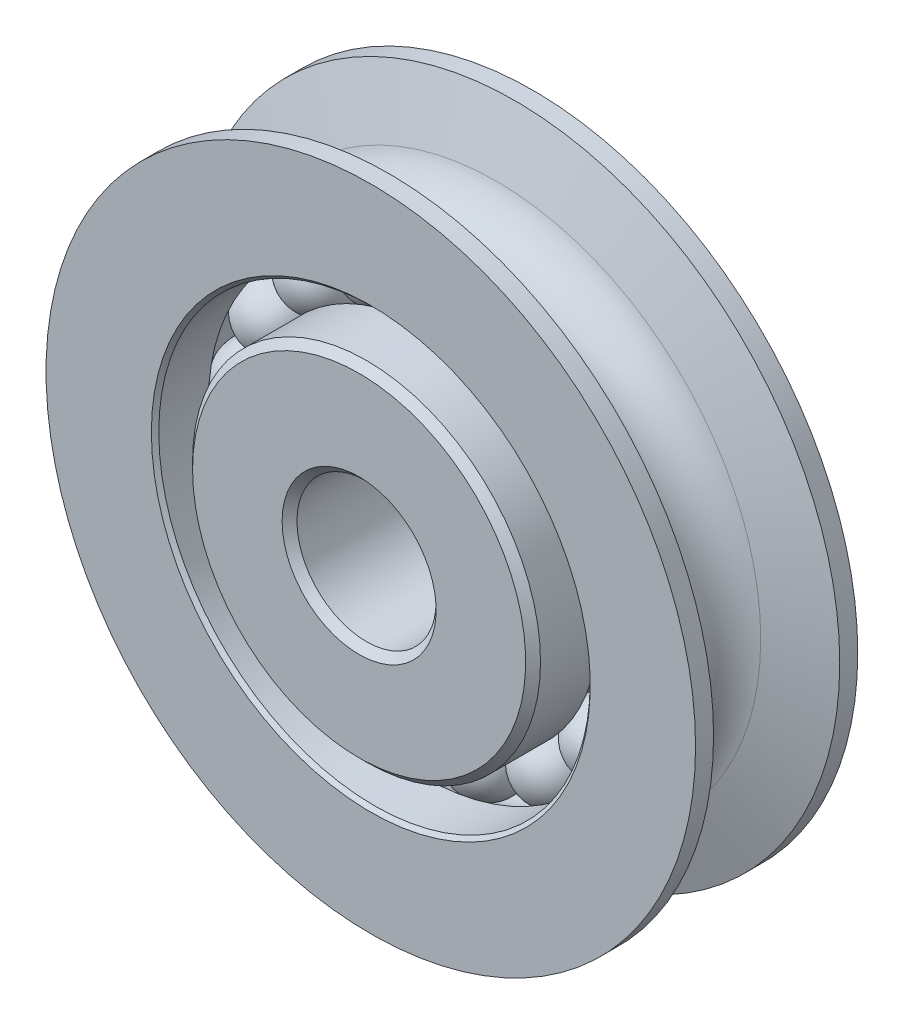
SolidWorks part; units mm, degrees
ref_plane "Front" through (0, 0, 0) normal (0, 0, 1) x (1, 0, 0)
ref_plane "Top" through (0, 0, 0) normal (0, 1, 0) x (1, 0, 0)
ref_plane "Right" through (0, 0, 0) normal (1, 0, 0) x (0, 0, -1)
sketch "Sketch1" plane through (0, 0, 0) normal (1, 0, 0) x (0, 0, -1)
  line L0 (4.318, 22.225) -> (5.5499, 22.225)
  line L1 (-4.318, 22.225) -> (-5.5499, 22.225)
  line L2 (-4.318, 22.225) -> (-3.0306, 18.1034)
  line L3 (1.905, 14.7638) -> (5.5499, 14.7638)
  line L4 (6.35, 4.7625) -> (-6.35, 4.7625)
  line L5 (-1.905, 11.9063) -> (-6.35, 11.9063)
  line L6 (4.318, 22.225) -> (3.0306, 18.1034)
  line L8 (-6.35, 0) -> (6.35, 0) construction
  line L10 (5.5499, 22.225) -> (5.5499, 14.7638)
  line L13 (-6.35, 11.9063) -> (-6.35, 4.7625)
  line L14 (0, 15.875) -> (0, -15.875) construction
  line L16 (6.35, 11.9063) -> (6.35, 4.7625)
  line L17 (-5.5499, 22.225) -> (-5.5499, -22.225) construction
  line L18 (-5.5499, 14.7638) -> (-1.905, 14.7638)
  line L20 (6.35, 11.9063) -> (1.905, 11.9063)
  line L21 (-5.5499, 14.7638) -> (-5.5499, 22.225)
  arc A0 (-3.0306, 18.1034) -> (3.0306, 18.1034) centre (0, 19.05) ccw
  circle A1 centre (0, 19.05) radius 3.175 construction
  circle A2 centre (0, 0) radius 4.7625 construction
  circle A3 centre (0, 0) radius 11.9063 construction
  arc A4 (-1.905, 11.9063) -> (1.905, 11.9063) centre (0, 13.335) ccw
  circle A5 centre (0, -19.05) radius 3.175 construction
  arc A6 (1.905, 14.7638) -> (-1.905, 14.7638) centre (0, 13.335) ccw
  point P28 (-5.5499, 0)
revolve "Revolve1" add sketch "Sketch1" angle 360 about L8
sketch "Sketch2" plane through (0, 0, 0) normal (1, 0, 0) x (0, 0, -1)
  line L0 (0, 15.875) -> (0, -15.875) construction
  line L1 (0, 15.7163) -> (0, 10.9538)
  arc A0 (1.905, 14.7638) -> (-1.905, 14.7638) centre (0, 13.335) ccw construction
  arc A1 (0, 10.9538) -> (0, 15.7163) centre (0, 13.335) ccw
revolve "Revolve2" add sketch "Sketch2" angle 360 about L1
pattern_circular "CirPattern1" count 17 over 360 about axis through (0, 0, 0) along (0, 0, 1)
chamfer "Chamfer1" distance 0.508 angle 45 4 edges at (4.7625, 0, -6.35) (11.9063, 0, -6.35) (11.9063, 0, 6.35) (4.7625, 0, 6.35)
chamfer "Chamfer2" distance 0.254 angle 45 2 edges at (14.7638, 0, -5.5499) (14.7638, 0, 5.5499)
equation "\"D1@Sketch1\" = \"Shaft Dia@Sketch1\" * 2.5"
equation "\"D2@Sketch1\" = \"Rope Dia@Sketch1\" * .75"
equation "\"D3@Sketch1\" = \"D2@Sketch1\" * .6"
